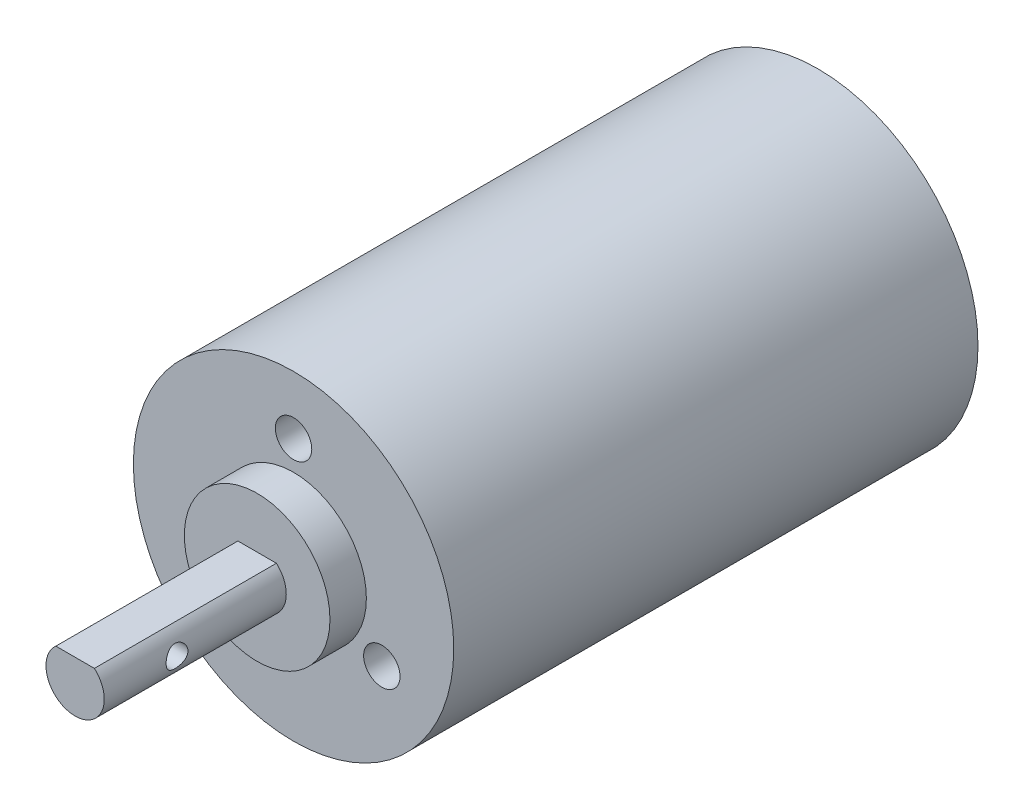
SolidWorks part; units mm, degrees
ref_plane "Plane1" through (0, 0, 0) normal (0, 0, 1) x (1, 0, 0)
ref_plane "Plane2" through (0, 0, 0) normal (0, 1, 0) x (1, 0, 0)
ref_plane "Plane3" through (0, 0, 0) normal (1, 0, 0) x (0, 0, -1)
sketch "Sketch1" plane through (0, 0, 0) normal (0, 0, 1) x (1, 0, 0)
  circle A0 centre (0, 0) radius 11
  dimension "D1" = 22
extrude "Base-Extrude" add sketch "Sketch1" against normal blind 36
sketch "Sketch2" plane through (0, 0, 0) normal (0, 0, 1) x (1, 0, 0)
  line L0 (-1.3229, 1.5) -> (1.3229, 1.5)
  arc A0 (-1.3229, 1.5) -> (1.3229, 1.5) centre (0, 0) ccw
  dimension "D1" = 4
  dimension "D2" = 1.5
extrude "Boss-Extrude1" add sketch "Sketch2" along normal blind 15
sketch "Sketch3" plane through (0, 0, -36) normal (0, 0, -1) x (-1, 0, 0)
  circle A0 centre (0, 0) radius 1
  dimension "D1" = 2
extrude "Cut-Extrude1" cut sketch "Sketch3" against normal blind 6.5
sketch "Sketch4" plane through (0, 0, 0) normal (0, 0, 1) x (1, 0, 0)
  circle A0 centre (0, 7) radius 1.25
  dimension "D1" = 2.5
  dimension "D2" = 7
extrude "Cut-Extrude2" cut sketch "Sketch4" against normal blind 4
pattern_circular "CirPattern1" count 3 over 360 about axis through (0, 0, 0) along (0, 0, 1) of "Cut-Extrude2"
sketch "Sketch5" plane through (0, 0, 0) normal (0, 0, 1) x (1, 0, 0)
  circle A0 centre (0, 0) radius 5
  dimension "D1" = 10
extrude "Boss-Extrude2" add sketch "Sketch5" along normal blind 2.5
sketch "Sketch6" plane through (0, 0, 0) normal (1, 0, 0) x (0, 0, -1)
  line L0 (36, 0) -> (0, 0) construction
  line L1 (-15, 1.5) -> (-15, -2) construction
  circle A0 centre (-10, 0) radius 0.75
  dimension "D1" = 1.5
  dimension "D2" = 5
extrude "Cut-Extrude3" cut sketch "Sketch6" against normal through all and the other way through all
